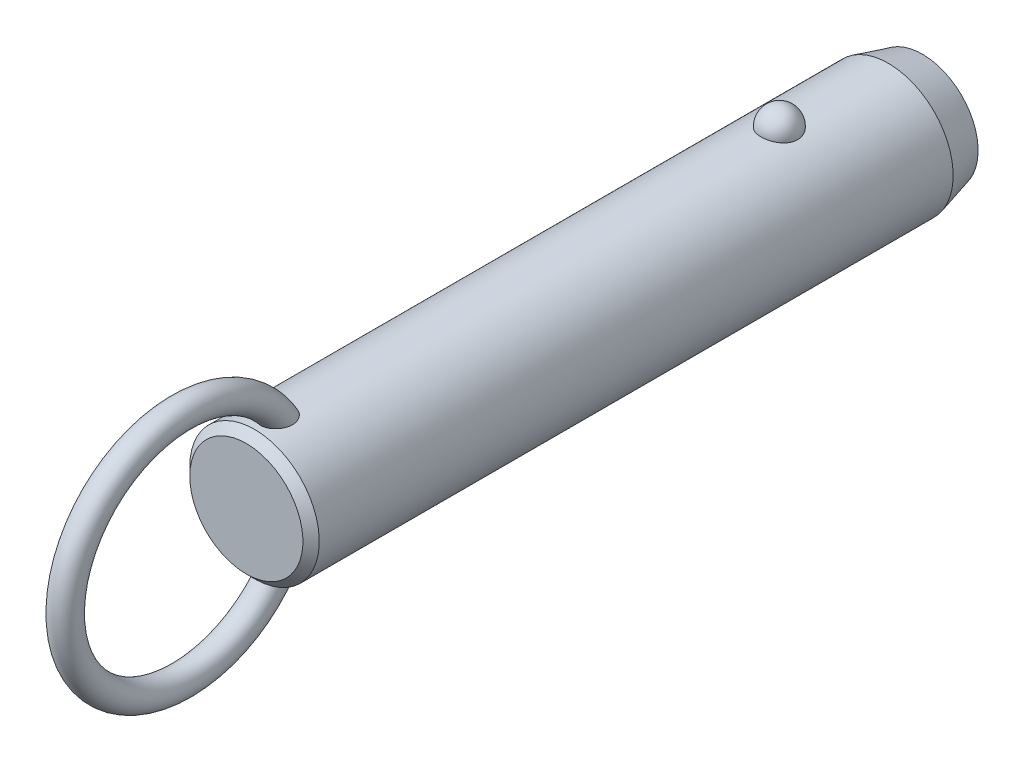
SolidWorks part; units mm, degrees
ref_plane "Front Plane" through (0, 0, 0) normal (0, 0, 1) x (1, 0, 0)
ref_plane "Top Plane" through (0, 0, 0) normal (0, 1, 0) x (1, 0, 0)
ref_plane "Right Plane" through (0, 0, 0) normal (1, 0, 0) x (0, 0, -1)
sketch "Sketch2" plane through (0, 0, 0) normal (0, 0, 1) x (1, 0, 0)
  circle A0 centre (0, 0) radius 9.5
  point P3 (0, 9.5)
  dimension "D1" = 19
extrude "Boss-Extrude1" add sketch "Sketch2" along normal blind 66
sketch "Sketch3" plane through (0, 0, 0) normal (0, 0, -1) x (-1, 0, 0)
  circle A0 centre (0, 0) radius 9.5
  dimension "D1" = 19
extrude "Boss-Extrude2" add sketch "Sketch3" along normal blind 23.7
chamfer "Chamfer1" distance 5 angle 15 1 edges at (-9.5, 0, -23.7)
sketch "Sketch12" plane through (0, 0, 0) normal (1, 0, 0) x (0, 0, -1)
  line L0 (-66, 9.5) -> (-66, -9.5) construction
  point P0 (-66, 0)
sketch "Sketch13" plane through (0, 0, 0) normal (1, 0, 0) x (0, 0, -1)
  circle A0 centre (-85.05, 0) radius 19.05
  point P2 (-66, 0)
  dimension "D1" = 38.1
sketch "Sketch14" plane through (0, 0, 0) normal (0, 1, 0) x (1, 0, 0)
  circle A0 centre (0, -68) radius 2
  point P2 (0, -66)
  dimension "D1" = 4
sweep "Sweep1" add profiles "Sketch14" path "Sketch13"
sketch "Sketch15" plane through (0, 0, 66) normal (0, 0, 1) x (1, 0, 0)
  circle A0 centre (0, 0) radius 9.5
  dimension "D1" = 19
extrude "Boss-Extrude3" add sketch "Sketch15" along normal blind 9.52
chamfer "Chamfer2" distance 1.2 angle 45 1 edges at (9.5, 0, 75.52)
sketch "Sketch18" plane through (0, 0, 0) normal (1, 0, 0) x (0, 0, -1)
  line L0 (18.7, 9.5) -> (-68.5378, 9.5) construction
  line L1 (2.7, 12.2) -> (2.7, 6.8)
  line L2 (-68.5378, -9.5) -> (18.7, -9.5) construction
  arc A0 (2.7, 12.2) -> (2.7, 6.8) centre (2.7, 9.5) ccw
  point P4 (0, 9.5)
  dimension "D1" = 21.7
revolve "Revolve1" add sketch "Sketch18" angle 360 about L1
